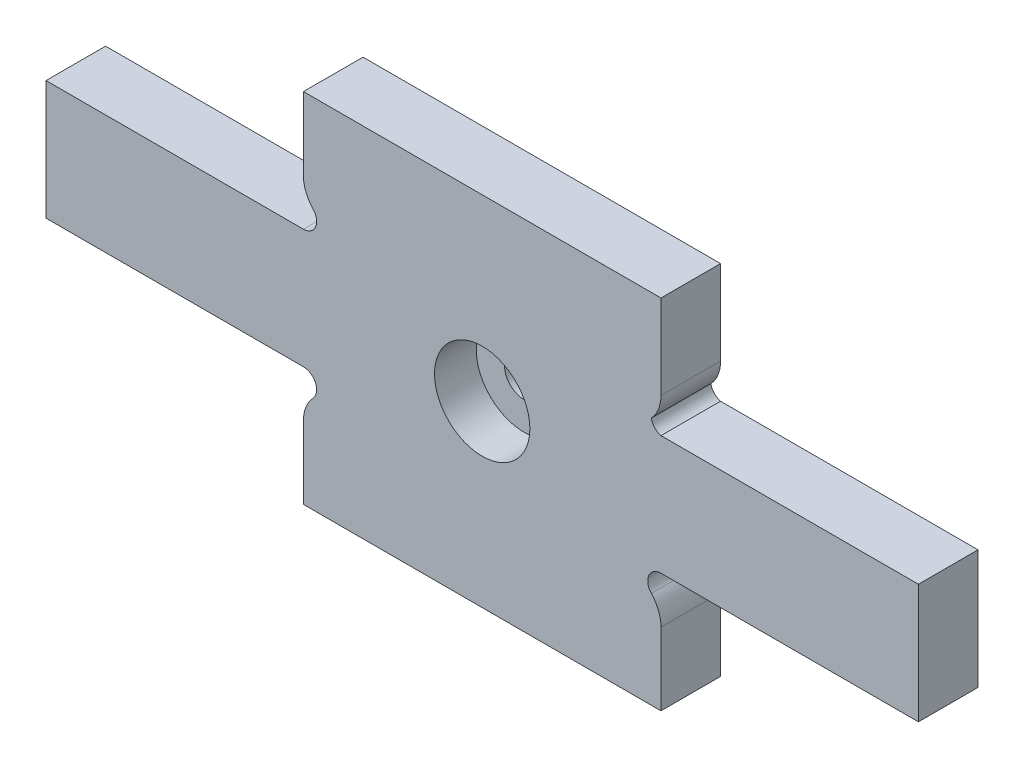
SolidWorks part; units mm, degrees
ref_plane "Plan de face" through (0, 0, 0) normal (0, 0, 1) x (1, 0, 0)
ref_plane "Plan de dessus" through (0, 0, 0) normal (0, 1, 0) x (1, 0, 0)
ref_plane "Plan de droite" through (0, 0, 0) normal (1, 0, 0) x (0, 0, -1)
sketch "Esquisse1" plane through (0, 0, 0) normal (0, 0, 1) x (1, 0, 0)
  line L6 (30, -10) -> (73.2, -10)
  line L7 (73.2, -10) -> (73.2, 10)
  line L8 (73.2, 10) -> (30, 10)
  line L9 (30, 15.8386) -> (30, 30)
  line L10 (30, 30) -> (-30, 30)
  line L11 (-30, 30) -> (-30, 17.374)
  line L12 (-30, 10) -> (-73.2, 10)
  line L13 (-73.2, 10) -> (-73.2, -10)
  line L14 (-73.2, -10) -> (-30, -10)
  line L15 (-30, -17.8386) -> (-30, -30)
  line L16 (-30, -30) -> (30, -30)
  line L17 (30, -30) -> (30, -17.8386)
  arc A0 (30, -17.8386) -> (28.3796, -13.7374) centre (24, -17.8386) ccw
  arc A1 (30, -10) -> (28.3796, -13.7374) centre (30, -12.22) ccw
  arc A2 (28.3796, 11.7374) -> (30, 10) centre (30.5613, 12.1479) ccw
  arc A3 (28.3796, 11.7374) -> (30, 15.8386) centre (24, 15.8386) ccw
  arc A4 (-30, 17.374) -> (-28.3796, 13.7374) centre (-24.0197, 17.8595) ccw
  arc A5 (-30, 10) -> (-28.3796, 13.7374) centre (-30, 12.22) ccw
  arc A6 (-28.3796, -13.7374) -> (-30, -10) centre (-30, -12.22) ccw
  arc A7 (-28.3796, -13.7374) -> (-30, -17.8386) centre (-24, -17.8386) ccw
  dimension "D1" = 60
  dimension "D2" = 20
  dimension "D3" = 20
  dimension "D4" = 30
  dimension "D5" = 60
  dimension "D6" = 30
  dimension "D7" = 10
  dimension "D8" = 10
extrude "Boss.-Extru.1" add sketch "Esquisse1" along normal blind 10
sketch "Esquisse3" plane through (0, 0, 10) normal (0, 0, 1) x (1, 0, 0)
  circle A0 centre (0, 0) radius 3.25
  dimension "D1" = 6.5
extrude "Enlèv. mat.-Extru.2" cut sketch "Esquisse3" against normal blind 10
sketch "Esquisse2" plane through (0, 0, 10) normal (0, 0, 1) x (1, 0, 0)
  circle A0 centre (0, 0) radius 8
  dimension "D1" = 16
extrude "Enlèv. mat.-Extru.1" cut sketch "Esquisse2" against normal blind 7
